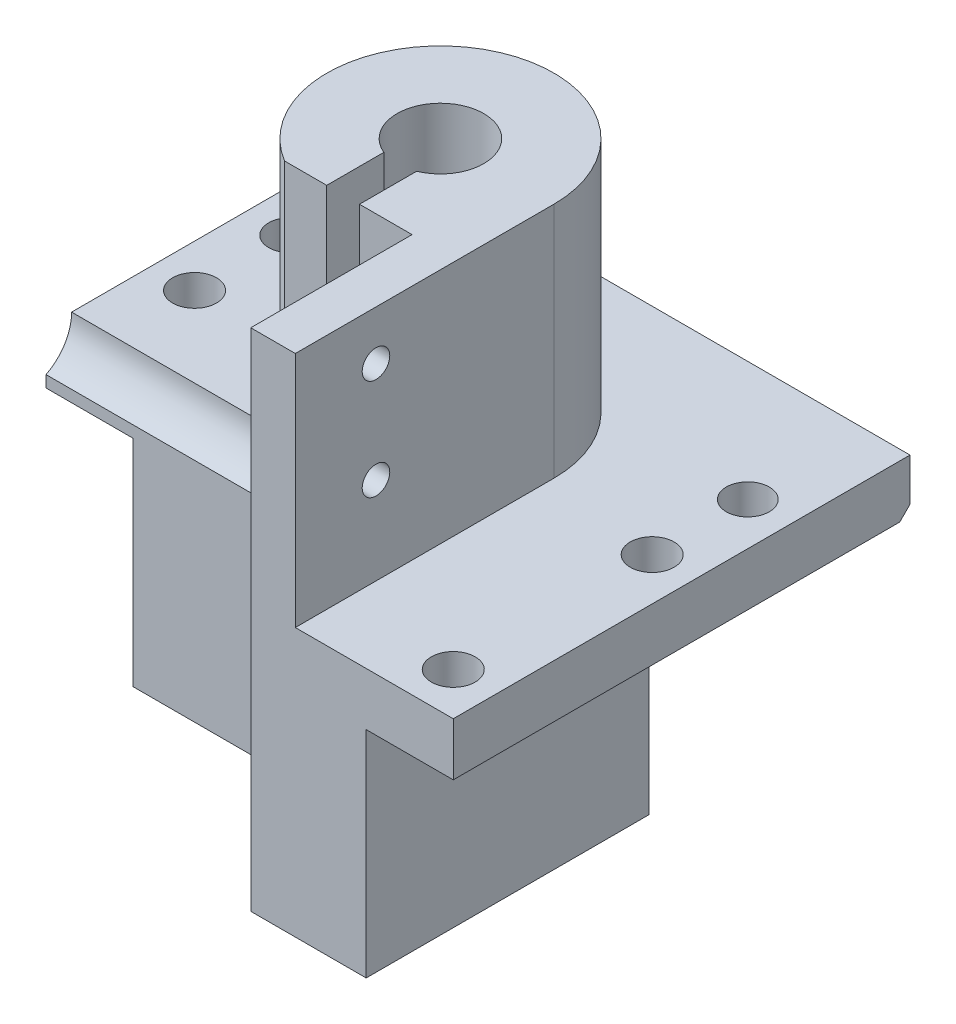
SolidWorks part; units mm, degrees
ref_plane "Front" through (0, 0, 0) normal (0, 0, 1) x (1, 0, 0)
ref_plane "Top" through (0, 0, 0) normal (0, 1, 0) x (1, 0, 0)
ref_plane "center" through (0, 0, 0) normal (1, 0, 0) x (0, 0, -1)
sketch "Sketch1" plane through (0, 0, 0) normal (0, 0, 1) x (1, 0, 0)
  line L1 (-8.4455, 21.59) -> (8.4455, 21.59)
  line L2 (-8.4455, 21.59) -> (-8.4455, 0)
  line L3 (-8.4455, 0) -> (8.4455, 0)
  line L4 (8.4455, 21.59) -> (8.4455, 0)
  dimension "D1" = 16.891
  dimension "D2" = 21.59
extrude "Extrude1" add sketch "Sketch1" along normal blind 25.4
sketch "Sketch3" plane through (0, 0, 0) normal (1, 0, 0) x (0, 0, -1)
  line L0 (-10.414, 19.4315) -> (-10.414, -6.3366) construction
  line L1 (-7.366, 0) -> (-7.366, 0.381)
  line L2 (-25.4, 0) -> (0, 0) construction
  line L3 (-7.366, 0) -> (-10.414, 0)
  line L4 (-10.414, 0) -> (-10.414, 21.59)
  line L5 (-7.366, 0.381) -> (-7.1882, 0.4286)
  line L6 (-7.1882, 0.4286) -> (-7.1882, 21.59)
  line L7 (-10.414, 21.59) -> (-7.1882, 21.59)
  line L9 (-25.4, 21.59) -> (0, 21.59) construction
  dimension "D1" = 10.414
  dimension "D2" = 6.4516
  dimension "D3" = 15
  dimension "D4" = 0.381
  dimension "D5" = 6.096
revolve "Cut-Revolve1" cut sketch "Sketch3" angle 360 about L0
sketch "Sketch7" plane through (0, 0, 0) normal (0, -1, 0) x (1, 0, 0)
  line L0 (13.716, 7.8405) -> (13.716, 25.4)
  line L1 (13.716, 25.4) -> (-13.716, 25.4)
  line L2 (-13.716, 25.4) -> (-13.716, 7.8405)
  line L3 (-8.4455, 25.4) -> (8.4455, 25.4) construction
  arc A0 (13.716, 7.8405) -> (-13.716, 7.8405) centre (0, 0) ccw
  point P7 (0, 25.4)
  dimension "D1" = 31.5976
  dimension "D2" = 27.432
extrude "Extrude2" add sketch "Sketch7" along normal blind 16.002
sketch "Sketch8" plane through (0, 0, 0) normal (0, 1, 0) x (-1, 0, 0)
  line L0 (-8.4455, 25.4) -> (-8.4455, 0)
  line L1 (-8.4455, 25.4) -> (-8.4455, 0) construction
  line L2 (-8.4455, 0) -> (0, 0)
  line L3 (-20.193, -4.318) -> (-20.193, 25.4)
  line L4 (-20.193, 25.4) -> (-8.4455, 25.4)
  line L5 (0, 0) -> (0, -4.318)
  line L6 (-20.193, -4.318) -> (0, -4.318)
  dimension "D1" = 4.318
  dimension "D2" = 20.193
extrude "Extrude3" add sketch "Sketch8" along normal blind 3.937
mirror "Mirror1" about plane through (0, 0, 0) normal (1, 0, 0) of "Extrude3"
sketch "Sketch10" plane through (0, 0, 0) normal (1, 0, 0) x (0, 0, -1)
  line L0 (-25.4, -16.002) -> (-7.8405, -16.002) construction
  line L1 (-25.4, 21.59) -> (-17.653, 21.59)
  line L2 (-25.4, 21.59) -> (-25.4, -16.002)
  line L3 (-25.4, -16.002) -> (-19.558, -16.002)
  line L4 (-19.558, 3.937) -> (-19.558, -16.002)
  line L5 (-19.558, 3.937) -> (-17.653, 3.937)
  line L6 (-17.653, 3.937) -> (-17.653, 21.59)
  line L7 (-25.4, 21.59) -> (0, 21.59) construction
  line L8 (-25.4, 3.937) -> (4.318, 3.937) construction
  dimension "D1" = 17.653
  dimension "D2" = 19.558
extrude "Cut-Extrude3" cut sketch "Sketch10" against normal through all and the other way blind 5.1308
sketch "Sketch11" plane through (0, 0, 0) normal (1, 0, 0) x (0, 0, -1)
  line L1 (-8.7078, 5.207) -> (-17.653, 5.207)
  line L2 (-8.7078, 5.207) -> (-8.7078, 21.59)
  line L3 (-8.7078, 21.59) -> (-17.653, 21.59)
  line L4 (-17.653, 5.207) -> (-17.653, 21.59)
  line L5 (-25.4, 3.937) -> (4.318, 3.937) construction
  dimension "D1" = 1.27
extrude "Cut-Extrude4" cut sketch "Sketch11" against normal blind 1.2192 and the other way blind 1.2192
fillet "Fillet2" radius 1.143 2 edges at (-1.2192, 5.207, 15.5268) (1.2192, 5.207, 15.5268)
sketch "Sketch12" plane through (0, 0, 25.4) normal (0, 0, 1) x (1, 0, 0)
  line L0 (5.1308, -16.002) -> (13.716, -16.002)
  line L1 (13.716, -16.002) -> (13.716, 0)
  line L2 (13.716, 0) -> (20.193, 0)
  line L3 (20.193, 0) -> (20.193, 3.937)
  line L4 (20.193, 3.937) -> (8.4455, 3.937)
  line L5 (8.4455, 3.937) -> (8.4455, 21.59)
  line L6 (8.4455, 21.59) -> (5.1308, 21.59)
  line L7 (5.1308, 21.59) -> (5.1308, -16.002)
extrude "Extrude5" add sketch "Sketch12" along normal up to surface (4.253 mm away)
sketch "Sketch13" plane through (5.1308, 0, 0) normal (-1, 0, 0) x (0, 0, 1)
  line L0 (17.653, 3.937) -> (17.653, 21.59) construction
  line L1 (0, 3.937) -> (29.653, 3.937) construction
  circle A0 centre (21.082, 3.937) radius 3.429
  dimension "D1" = 6.858
extrude "Cut-Extrude5" cut sketch "Sketch13" along normal through all
chamfer "Chamfer1" distance 0.762 angle 45 1 edges at (0, 0, -4.318)
sketch "Sketch14" plane through (0, 21.59, 0) normal (0, 1, 0) x (-1, 0, 0)
  line L0 (-8.4455, 29.653) -> (-8.4455, 0) construction
  line L1 (-8.4455, 0) -> (-8.4455, 10.414)
  line L2 (-8.4455, 0) -> (16.5558, 0)
  line L3 (2.1339, 18.5855) -> (16.5558, 18.5855)
  line L4 (-8.4455, 0) -> (8.4455, 0) construction
  line L5 (16.5558, 0) -> (16.5558, 18.5855)
  arc A0 (-8.4455, 10.414) -> (2.1339, 18.5855) centre (0, 10.414) ccw
  circle A1 centre (0, 10.414) radius 3.048 construction
extrude "Cut-Extrude6" cut sketch "Sketch14" against normal up to surface (17.653 mm away)
hole_wizard "M2.05 (2.05) Diameter Hole1" positions "Sketch17" profile "Sketch16" hole size "M2.05" standard "Ansi Metric"
sketch "Sketch17" plane through (8.4455, 0, 0) normal (1, 0, 0) x (0, 0, -1)
  circle A0 centre (-23.653, 17.937) radius 0.8 construction
  circle A1 centre (-23.653, 10.437) radius 0.8 construction
  point P0 (-23.653, 17.937)
  point P1 (-23.653, 10.437)
sketch "Sketch16" plane through (8.4455, 17.937, 23.653) normal (0, 1, 0) x (0, 0, -1)
  line L0 (0, 0) -> (0, 28.6385)
  line L1 (0, 28.6385) -> (1.025, 28.6385)
  line L2 (1.025, 28.6385) -> (1.025, 0)
  line L5 (1.025, 0) -> (0, 0)
  line L11 (0, -6.35) -> (0, 107.95) construction
  dimension "Thru Hole Dia." = 2.05
  dimension "Thru Hole Depth" = 28.6385
sketch "Sketch18" plane through (0, 0, 0) normal (0, -1, 0) x (1, 0, 0)
  line L1 (-24.0507, -9.7177) -> (23.5406, -9.7177)
  line L2 (-24.0507, -9.7177) -> (-24.0507, 8.6025)
  line L3 (-24.0507, 8.6025) -> (23.5406, 8.6025)
  line L4 (23.5406, -9.7177) -> (23.5406, 8.6025)
  dimension "D1" = 0.762
extrude "Cut-Extrude7" cut sketch "Sketch18" along normal through all
hole_wizard "#4-40 Tapped Hole1" positions "Sketch21" profile "Sketch20" tap size "#4-40" standard "Ansi Inch"
sketch "Sketch21" plane through (0, -16.002, 0) normal (0, -1, 0) x (1, 0, 0)
  circle A0 centre (-10.287, 16.637) radius 1.4732 construction
  circle A1 centre (9.271, 16.637) radius 1.6319 construction
  point P0 (-10.287, 16.637)
  point P1 (9.271, 16.637)
sketch "Sketch20" plane through (-10.287, -16.002, 16.637) normal (1, 0, 0) x (0, 0, -1)
  line L0 (0, 0) -> (0, 12.065)
  line L1 (0, 12.065) -> (1.1303, 12.065)
  line L2 (1.1303, 12.065) -> (1.1303, 0)
  line L5 (1.1303, 0) -> (0, 0)
  line L10 (0, 12.065) -> (-1.1303, 12.065) construction
  line L11 (0, -6.35) -> (0, 107.95) construction
  dimension "Tap Drill Dia." = 2.2606
  dimension "Tap Drill Depth" = 12.065
  dimension "Drill Angle" = 180
hole_wizard "1/8 (0.125) Diameter Hole1" positions "Sketch23" profile "Sketch22" hole size "1/8" standard "Ansi Inch"
sketch "Sketch23" plane through (0, -16.002, 0) normal (0, -1, 0) x (1, 0, 0)
  line L0 (13.716, 29.653) -> (5.1308, 29.653) construction
  line L3 (9.271, 25.462) -> (9.271, 16.637) construction
  circle A1 centre (9.271, 16.637) radius 1.1303 construction
  point P0 (9.271, 25.462)
  dimension "D1" = 4.191
sketch "Sketch22" plane through (9.271, -16.002, 25.462) normal (1, 0, 0) x (0, 0, -1)
  line L0 (0, 0) -> (0, 6.35)
  line L1 (0, 6.35) -> (1.5837, 6.35)
  line L2 (1.5837, 6.35) -> (1.5837, 0)
  line L5 (1.5837, 0) -> (0, 0)
  line L10 (0, 6.35) -> (-1.5837, 6.35) construction
  line L11 (0, -6.35) -> (0, 107.95) construction
  dimension "Hole Dia." = 3.1674
  dimension "Hole Depth" = 6.35
  dimension "Drill Angle" = 180
hole_wizard "#30 (0.1285) Diameter Hole1" positions "Sketch25" profile "Sketch24" hole size "#30" standard "Ansi Inch"
sketch "Sketch25" plane through (0, 0, 0) normal (0, -1, 0) x (1, 0, 0)
  line L0 (-20.193, 17.653) -> (-4.3501, 17.653) construction
  line L2 (-20.193, 19.558) -> (-20.193, -3.556) construction
  line L3 (20.193, 29.653) -> (20.193, -3.556) construction
  line L4 (20.193, 29.653) -> (13.716, 29.653) construction
  point P0 (-17.018, 11.684)
  point P1 (17.018, 11.684)
  point P2 (17.018, 26.478)
  dimension "D1" = 5.969
  dimension "D2" = 3.175
  dimension "D3" = 3.175
  dimension "D4" = 3.175
sketch "Sketch24" plane through (-17.018, 0, 11.684) normal (1, 0, 0) x (0, 0, -1)
  line L0 (0, 0) -> (0, 21.59)
  line L1 (0, 21.59) -> (1.6319, 21.59)
  line L2 (1.6319, 21.59) -> (1.6319, 0)
  line L5 (1.6319, 0) -> (0, 0)
  line L11 (0, -6.35) -> (0, 107.95) construction
  dimension "Thru Hole Dia." = 3.2639
  dimension "Thru Hole Depth" = 21.59
hole_wizard "1/8 (0.125) Diameter Hole2" positions "Sketch27" profile "Sketch26" hole size "1/8" standard "Ansi Inch"
sketch "Sketch27" plane through (0, 3.937, 0) normal (0, 1, 0) x (-1, 0, 0)
  line L0 (20.193, 17.653) -> (20.193, -4.318) construction
  line L1 (-20.193, -4.318) -> (20.193, -4.318) construction
  line L2 (-20.193, 29.653) -> (-20.193, -4.318) construction
  point P0 (-17.018, 4.572)
  point P1 (17.018, 4.572)
  dimension "D1" = 3.175
  dimension "D2" = 8.89
  dimension "D3" = 3.175
sketch "Sketch26" plane through (17.018, 3.937, 4.572) normal (1, 0, 0) x (0, 0, 1)
  line L0 (0, 0) -> (0, 19.939)
  line L1 (0, 19.939) -> (1.6002, 19.939)
  line L2 (1.6002, 19.939) -> (1.6002, 0)
  line L5 (1.6002, 0) -> (0, 0)
  line L11 (0, -6.35) -> (0, 107.95) construction
  dimension "Thru Hole Dia." = 3.2004
  dimension "Thru Hole Depth" = 19.939
